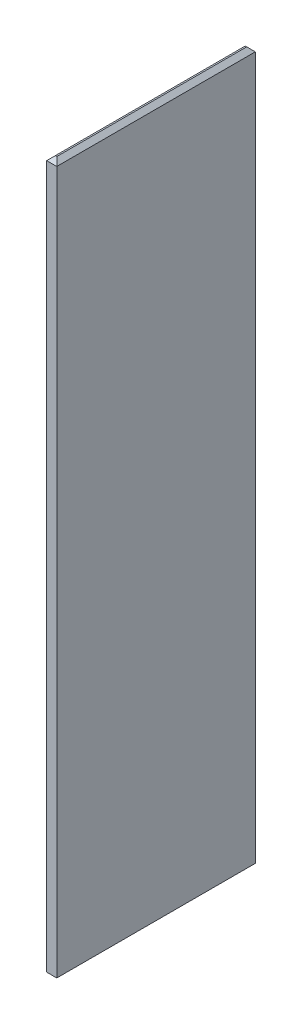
SolidWorks part; units mm, degrees
ref_plane "Front Plane" through (0, 0, 0) normal (1, 0, 0) x (0, 1, 0)
ref_plane "Top Plane" through (0, 0, 0) normal (0, 0, 1) x (0, 1, 0)
ref_plane "Right Plane" through (0, 0, 0) normal (0, 1, 0) x (-1, 0, 0)
sketch "Sketch1" plane through (0, 0, 0) normal (0, 1, 0) x (-1, 0, 0)
  line L1 (-76.2, 1500) -> (76.2, 1500)
  line L2 (-76.2, 1500) -> (-76.2, -1500)
  line L3 (-76.2, -1500) -> (76.2, -1500)
  line L4 (76.2, 1500) -> (76.2, -1500)
  line L5 (-76.2, 1500) -> (76.2, -1500) construction
  line L6 (-76.2, -1500) -> (76.2, 1500) construction
  point P0 (0, 0)
  dimension "D1" = 3000
  dimension "D2" = 152.4
extrude "Boss-Extrude1" add sketch "Sketch1" along normal blind 10749.8
ref_plane "Mating plane" through (0, 0, -1750) normal (0, 0, -1) x (0, 1, 0)
chamfer "Chamfer1" distance 65 angle 45 8 edges at (0, 0, 1500) (76.2, 0, 0) (0, 0, -1500) (-76.2, 0, 0) (0, 10749.8, -1500) (76.2, 10749.8, 0) (0, 10749.8, 1500) (-76.2, 10749.8, 0)
